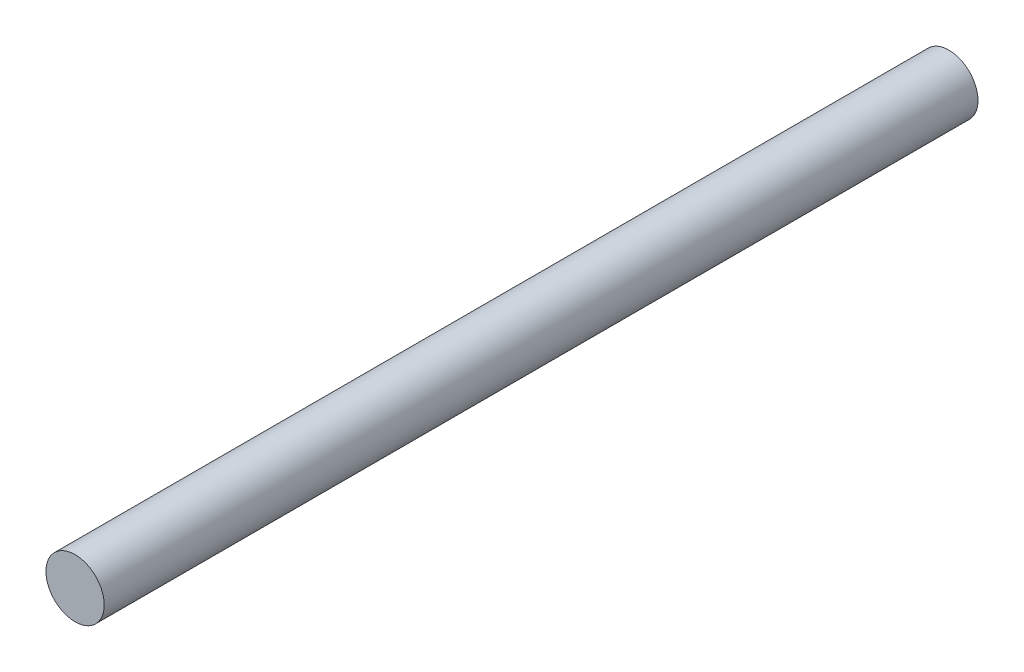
SolidWorks part; units mm, degrees
ref_plane "Plan de face" through (0, 0, 0) normal (0, 0, 1) x (1, 0, 0)
ref_plane "Plan de dessus" through (0, 0, 0) normal (0, 1, 0) x (1, 0, 0)
ref_plane "Plan de droite" through (0, 0, 0) normal (1, 0, 0) x (0, 0, -1)
sketch "Esquisse1" plane through (0, 0, 0) normal (0, 0, 1) x (1, 0, 0)
  circle A0 centre (0, 0) radius 5
  dimension "D1" = 10
extrude "Extrusion1" add sketch "Esquisse1" along normal blind 150
